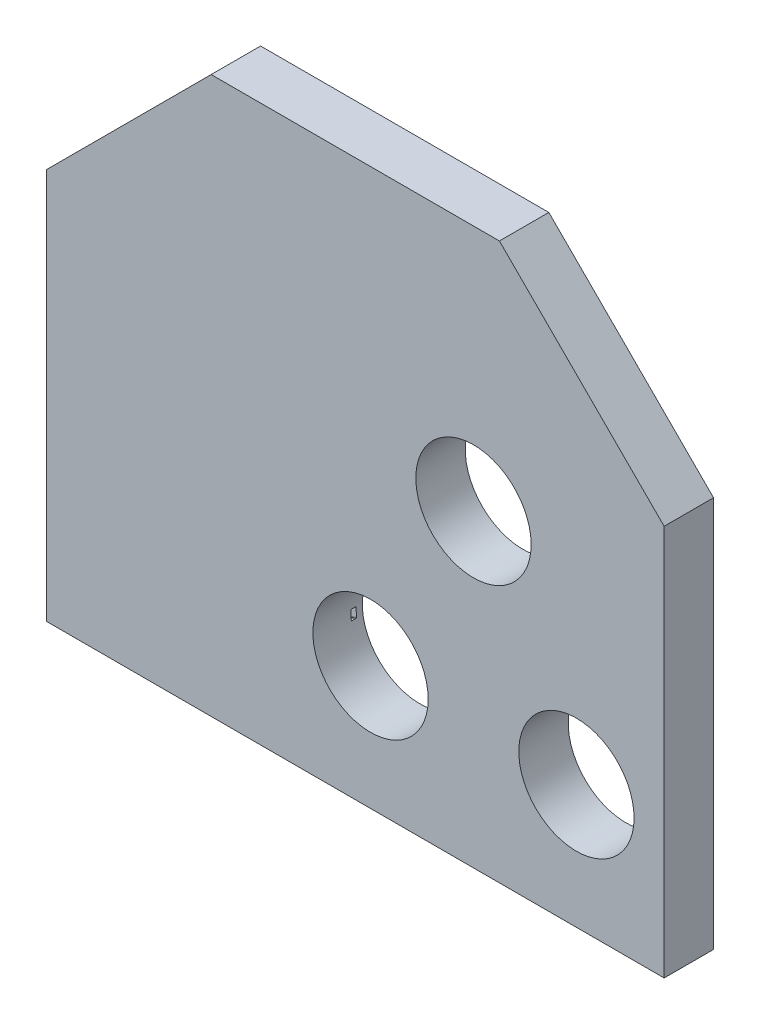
SolidWorks part; units mm, degrees
ref_plane "Aufriss" through (0, 0, 0) normal (0, 0, 1) x (1, 0, 0)
ref_plane "Grundriss" through (0, 0, 0) normal (0, 1, 0) x (1, 0, 0)
ref_plane "Seitenriss" through (0, 0, 0) normal (1, 0, 0) x (0, 0, -1)
sketch "Skizze1" plane through (0, 0, 0) normal (0, 0, 1) x (1, 0, 0)
  line L1 (0, 0) -> (150, 0)
  line L2 (0, 0) -> (0, 135)
  line L3 (0, 135) -> (150, 135)
  line L4 (150, 0) -> (150, 135)
  dimension "D1" = 135
  dimension "D2" = 150
extrude "Linear austragen1" add sketch "Skizze1" along normal blind 12
sketch "Skizze2" plane through (0, 0, 12) normal (0, 0, 1) x (1, 0, 0)
  line L0 (103.7, 135) -> (103.7, 0) construction
  line L2 (0, 0) -> (150, 0) construction
  line L3 (50.8051, 30) -> (142.7662, 30) construction
  line L4 (0, 135) -> (0, 0) construction
  circle A0 centre (78.7, 30) radius 14
  circle A2 centre (128.7, 30) radius 14
  circle A3 centre (103.7, 75) radius 14
  dimension "D1" = 28
  dimension "D2" = 25
  dimension "D5" = 75
  dimension "D6" = 25
  dimension "D3" = 30
  dimension "D4" = 103.7
extrude "Linear austragen2" cut sketch "Skizze2" against normal blind 12
ref_plane "Ebene1" through (58, 40.9, 0) normal (-1, 0, 0) x (0, -1, 0)
sketch "Skizze4" plane through (58, 40.9, 0) normal (-1, 0, 0) x (0, -1, 0)
  line L0 (14.57, 1.5) -> (12.6, 1.5)
  line L1 (12.6, 1.5) -> (12.6, 2.8)
  line L2 (12.6, 2.8) -> (14.57, 2.8)
  line L3 (14.7, 2.67) -> (14.7, 1.63)
  line L4 (0, -50) -> (0, 50) construction
  line L5 (-3.1, 0) -> (24.9, 0) construction
  arc A0 (14.7, 1.63) -> (14.57, 1.5) centre (14.57, 1.63) cw
  arc A1 (14.7, 2.67) -> (14.57, 2.8) centre (14.57, 2.67) ccw
  dimension "D1" = 0.13
  dimension "D2" = 0.13
  dimension "D3" = 1.5
revolve "Nut für DIN 472 - 28 x 1.2, Sicherungsring für Bohrungen - Regelausf.1" cut sketch "Skizze4"
ref_plane "Ebene2" through (98, 40.9, 0) normal (-1, 0, 0) x (0, -1, 0)
sketch "Skizze6" plane through (98, 40.9, 0) normal (-1, 0, 0) x (0, -1, 0)
  line L0 (14.57, 1.5) -> (12.6, 1.5)
  line L1 (12.6, 1.5) -> (12.6, 2.8)
  line L2 (12.6, 2.8) -> (14.57, 2.8)
  line L3 (14.7, 2.67) -> (14.7, 1.63)
  line L4 (0, -50) -> (0, 50) construction
  line L5 (-3.1, 0) -> (24.9, 0) construction
  arc A0 (14.7, 1.63) -> (14.57, 1.5) centre (14.57, 1.63) cw
  arc A1 (14.7, 2.67) -> (14.57, 2.8) centre (14.57, 2.67) ccw
  dimension "D1" = 0.13
  dimension "D2" = 0.13
  dimension "D3" = 1.5
revolve "Nut für DIN 472 - 28 x 1.2, Sicherungsring für Bohrungen - Regelausf.2" cut sketch "Skizze6" angle 360 about L4
ref_plane "Ebene3" through (58, 100.9, 0) normal (-1, 0, 0) x (0, -1, 0)
sketch "Skizze8" plane through (58, 100.9, 0) normal (-1, 0, 0) x (0, -1, 0)
  line L0 (14.57, 1.5) -> (12.6, 1.5)
  line L1 (12.6, 1.5) -> (12.6, 2.8)
  line L2 (12.6, 2.8) -> (14.57, 2.8)
  line L3 (14.7, 2.67) -> (14.7, 1.63)
  line L4 (0, -50) -> (0, 50) construction
  arc A0 (14.7, 1.63) -> (14.57, 1.5) centre (14.57, 1.63) cw
  arc A1 (14.7, 2.67) -> (14.57, 2.8) centre (14.57, 2.67) ccw
  dimension "D1" = 0.13
  dimension "D2" = 0.13
revolve "Nut für DIN 472 - 28 x 1.2, Sicherungsring für Bohrungen - Regelausf.3" cut sketch "Skizze8" angle 360 about L4
chamfer "Fase1" distance 40 angle 45 2 edges at (0, 135, 6) (150, 135, 6)
